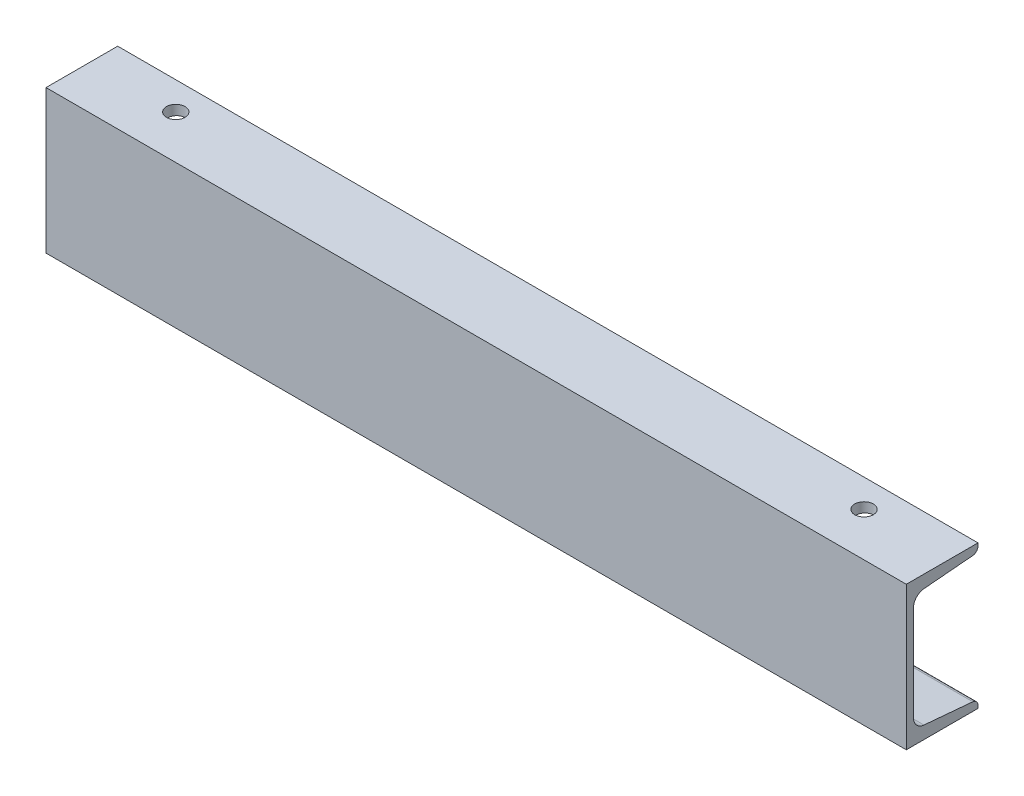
SolidWorks part; units mm, degrees
ref_plane "前视基准面" through (0, 0, 0) normal (0, 0, 1) x (1, 0, 0)
ref_plane "上视基准面" through (0, 0, 0) normal (0, 1, 0) x (1, 0, 0)
ref_plane "右视基准面" through (0, 0, 0) normal (1, 0, 0) x (0, 0, -1)
sketch "草图1" plane through (0, 0, 0) normal (1, 0, 0) x (0, 0, -1)
  line L0 (0, 0) -> (0, 100)
  line L1 (0, 100) -> (50, 100)
  line L2 (0, 0) -> (50, 0)
  line L12 (5, 83.2009) -> (5, 16.7991)
  line L15 (50, 100) -> (50, 98.1338)
  line L16 (50, 0) -> (50, 1.8662)
  line L17 (12.3028, 91.1704) -> (46.3486, 94.149)
  line L18 (12.3028, 8.8296) -> (46.3486, 5.851)
  arc A9 (5, 16.7991) -> (12.3028, 8.8296) centre (13, 16.7991) ccw
  arc A10 (5, 83.2009) -> (12.3028, 91.1704) centre (13, 83.2009) cw
  arc A11 (50, 98.1338) -> (46.3486, 94.149) centre (46, 98.1338) cw
  arc A12 (50, 1.8662) -> (46.3486, 5.851) centre (46, 1.8662) ccw
extrude "拉伸1" add sketch "草图1" along normal blind 600
sketch "草图5" plane through (0, 100, 0) normal (0, 1, 0) x (-1, 0, 0)
  line L0 (-600, -50) -> (0, -50) construction
  line L1 (-600, -50) -> (-600, 0) construction
  line L2 (-300, -50) -> (-300, 101.9234) construction
  circle A0 centre (-540, -30.5) radius 6.5
  circle A1 centre (-60, -30.5) radius 6.5
  dimension "D1" = 19.5
  dimension "D2" = 60
  dimension "D3" = 13
extrude "切除-拉伸1" cut sketch "草图5" against normal blind 10
